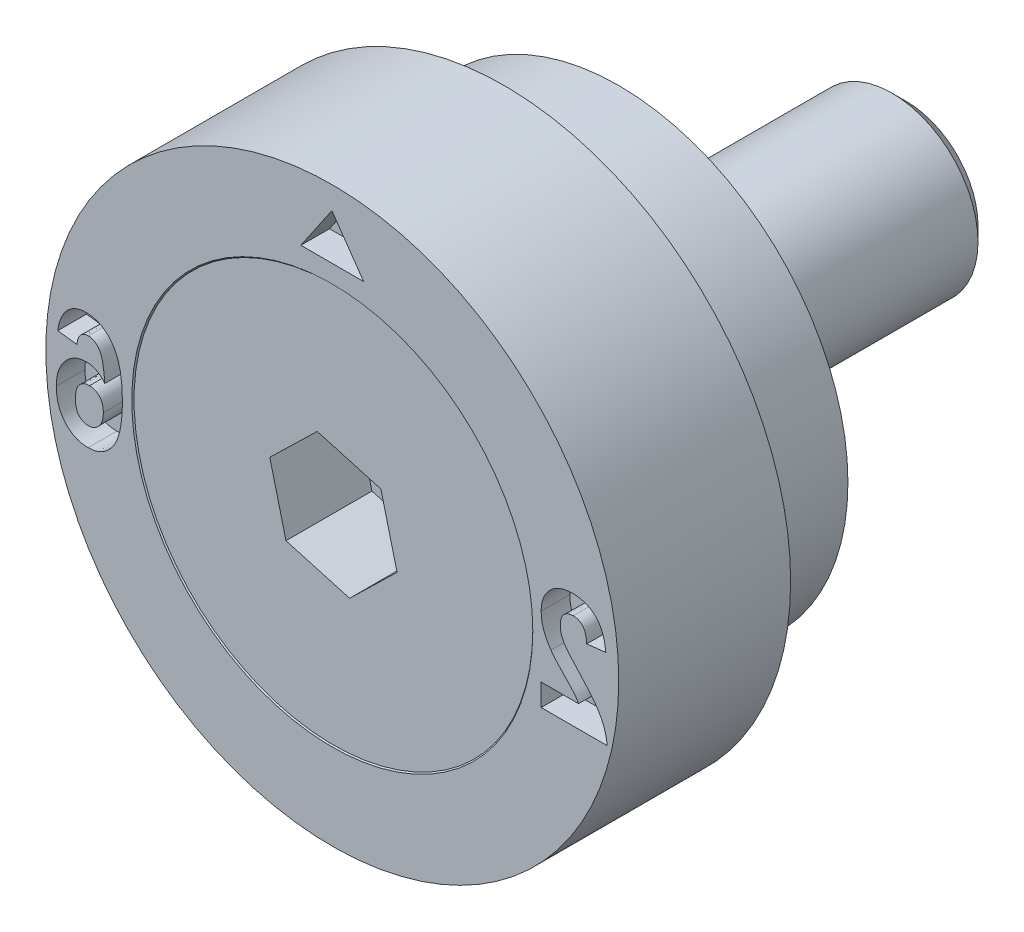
SolidWorks part; units mm, degrees
other "<M3 X .5 FHCS>-<Imported1>"
ref_plane "Front Plane" through (0, 0, 0) normal (0, 0, 1) x (1, 0, 0)
ref_plane "Top Plane" through (0, 0, 0) normal (0, 1, 0) x (1, 0, 0)
ref_plane "Right Plane" through (0, 0, 0) normal (1, 0, 0) x (0, 0, -1)
imported_body "Imported1"
sketch "Sketch1" plane through (0, 0, 0) normal (0, 0, 1) x (1, 0, 0)
  text T0 "2          6" font "Arial" height 2
  dimension "D1" = 1.0795
  dimension "D2" = 4.9022
extrude "Cut-Extrude1" cut sketch "Sketch1" against normal blind 0.5
inserted part "M3 X .5 FHCS"
move or copy body "Body-Move/Copy2" placed by mates yes
